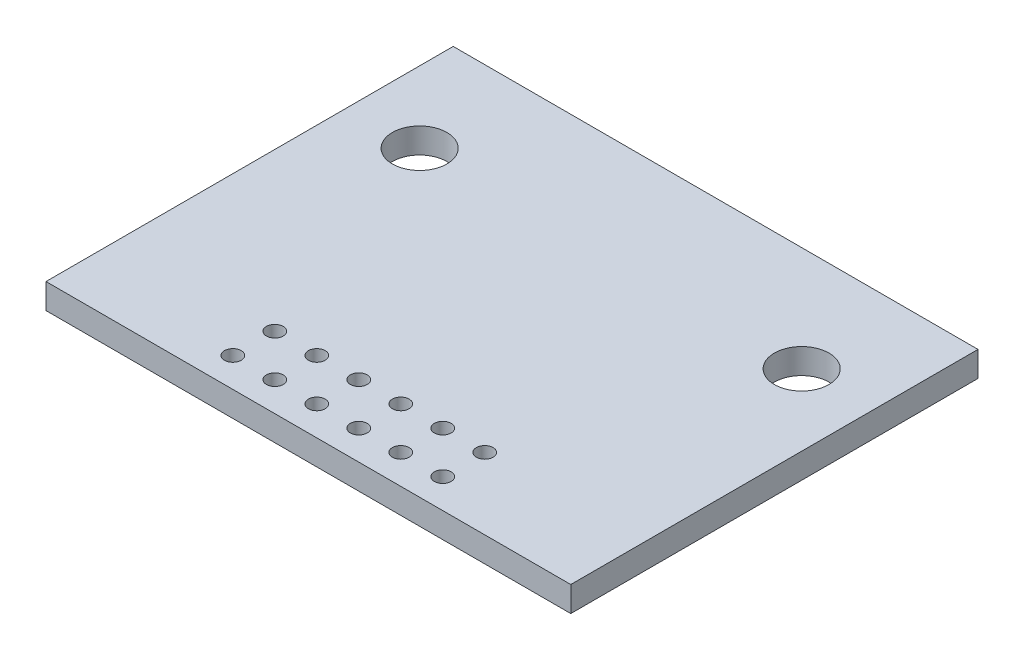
SolidWorks part; units mm, degrees
ref_plane "Front Plane" through (0, 0, 0) normal (0, 0, 1) x (1, 0, 0)
ref_plane "Top Plane" through (0, 0, 0) normal (0, 1, 0) x (1, 0, 0)
ref_plane "Right Plane" through (0, 0, 0) normal (1, 0, 0) x (0, 0, -1)
sketch "Sketch1" plane through (0, 0, 0) normal (0, 1, 0) x (1, 0, 0)
  line L0 (9.525, 1.778) -> (12.065, 1.778) construction
  line L1 (0, 24.638) -> (31.75, 24.638)
  line L2 (0, 24.638) -> (0, 0)
  line L3 (0, 0) -> (31.75, 0)
  line L4 (31.75, 24.638) -> (31.75, 0)
  line L5 (12.065, 1.778) -> (14.605, 1.778) construction
  line L6 (14.605, 1.778) -> (17.145, 1.778) construction
  line L7 (17.145, 1.778) -> (19.685, 1.778) construction
  line L8 (19.685, 1.778) -> (22.225, 1.778) construction
  line L9 (22.225, 1.778) -> (22.225, 4.318) construction
  line L10 (4.318, 18.288) -> (0, 18.288) construction
  line L11 (27.432, 18.288) -> (31.75, 18.288) construction
  circle A0 centre (9.525, 1.778) radius 0.508
  circle A1 centre (12.065, 1.778) radius 0.508
  circle A2 centre (14.605, 1.778) radius 0.508
  circle A3 centre (17.145, 1.778) radius 0.508
  circle A4 centre (19.685, 1.778) radius 0.508
  circle A5 centre (19.685, 4.318) radius 0.508
  circle A6 centre (17.145, 4.318) radius 0.508
  circle A7 centre (14.605, 4.318) radius 0.508
  circle A8 centre (12.065, 4.318) radius 0.508
  circle A9 centre (9.525, 4.318) radius 0.508
  circle A10 centre (22.225, 1.778) radius 0.508
  circle A11 centre (22.225, 4.318) radius 0.508
  circle A12 centre (4.318, 18.288) radius 1.651
  circle A13 centre (27.432, 18.288) radius 1.651
  dimension "D2" = 1.016
  dimension "D5" = 3.302
  dimension "D1" = 2.54
  dimension "D3" = 1.778
  dimension "D4" = 13.97
  dimension "D6" = 23.114
  dimension "D7" = 5.207
  dimension "D8" = 31.75
  dimension "D9" = 6.35
extrude "Extrude1" add sketch "Sketch1" along normal blind 1.524
